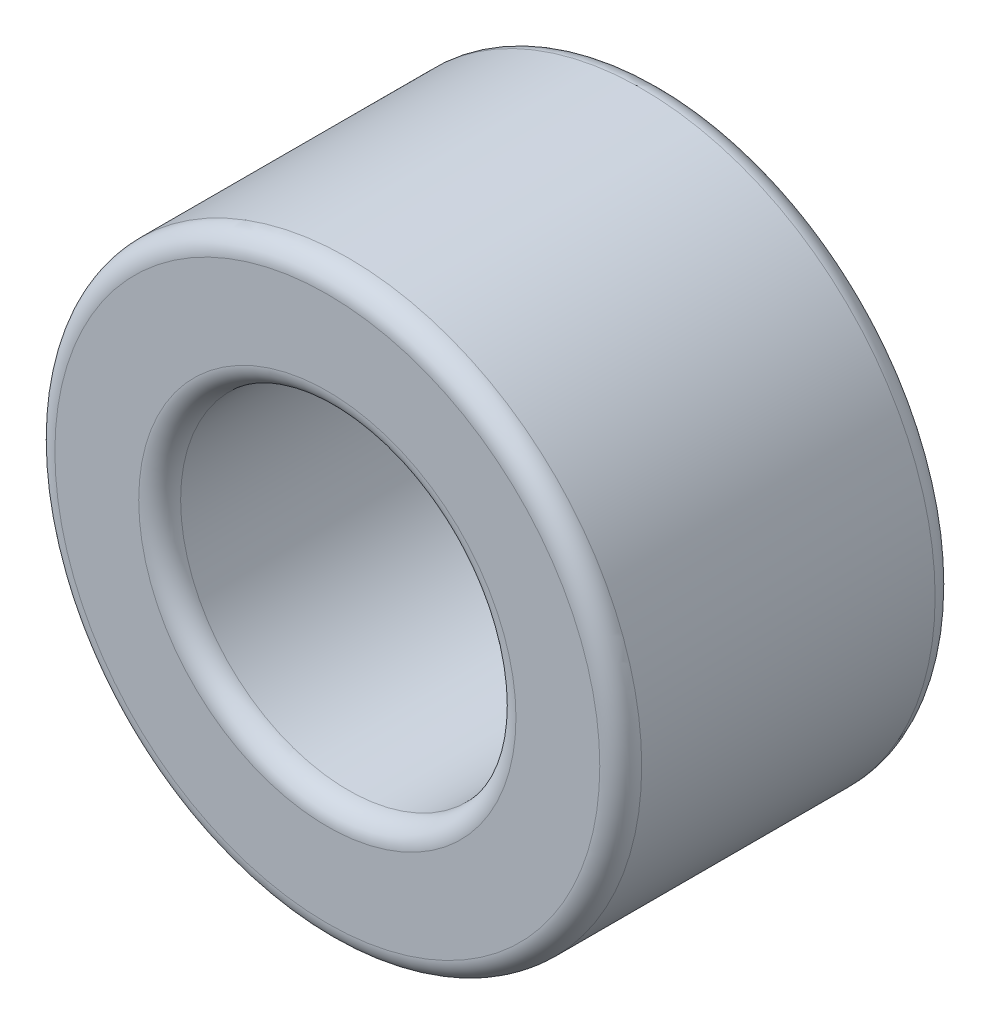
SolidWorks part; units mm, degrees
ref_plane "Спереди" through (0, 0, 0) normal (0, 0, 1) x (1, 0, 0)
ref_plane "Сверху" through (0, 0, 0) normal (0, 1, 0) x (1, 0, 0)
ref_plane "Справа" through (0, 0, 0) normal (1, 0, 0) x (0, 0, -1)
sketch "Эскиз1" plane through (0, 0, 0) normal (1, 0, 0) x (0, 0, -1)
  line L0 (-4, 0) -> (4, 0) construction
  line L1 (-4, 4) -> (4, 4)
  line L2 (4, 4) -> (4, 7)
  line L3 (4, 7) -> (-4, 7)
  line L4 (-4, 7) -> (-4, 4)
  dimension "D1" = 8
  dimension "D2" = 14
  dimension "D3" = 8
revolve "Повернуть1" add sketch "Эскиз1" angle 360 about L0
fillet "Скругление1" radius 0.5 4 edges at (7, 0, -4) (7, 0, 4) (4, 0, 4) (4, 0, -4)
